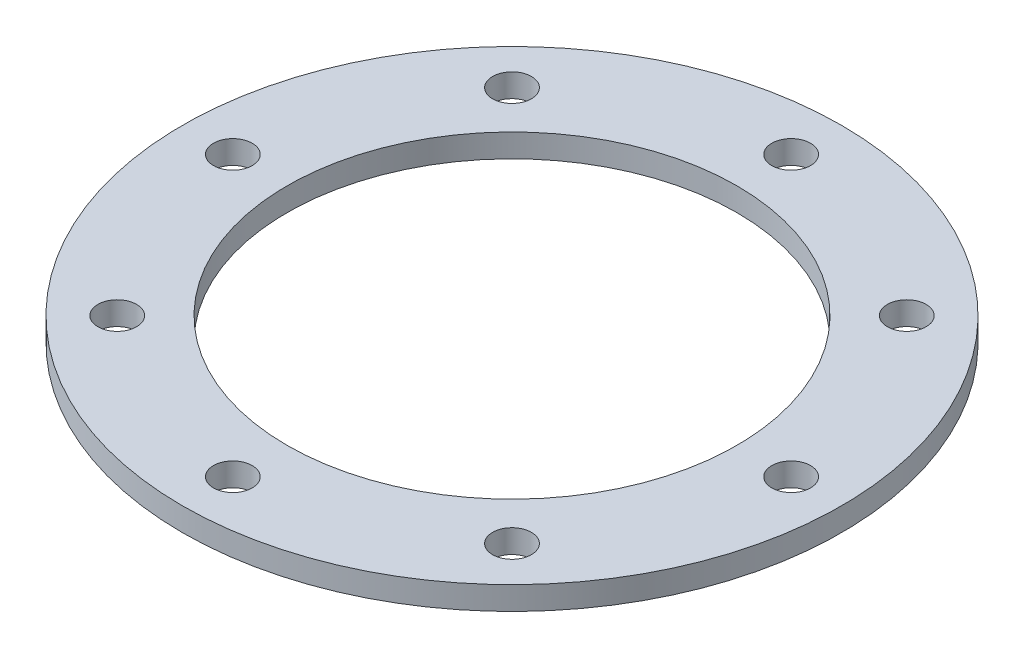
SolidWorks part; units mm, degrees
ref_plane "Front Plane" through (0, 0, 0) normal (0, 0, 1) x (1, 0, 0)
ref_plane "Top Plane" through (0, 0, 0) normal (0, 1, 0) x (1, 0, 0)
ref_plane "Right Plane" through (0, 0, 0) normal (1, 0, 0) x (0, 0, -1)
sketch "Sketch1" plane through (0, 0, 0) normal (0, 1, 0) x (1, 0, 0)
  circle A0 centre (0, 0) radius 42.5
  circle A1 centre (0, 0) radius 36 construction
  circle A2 centre (0, 0) radius 29
  circle A3 centre (36, 0) radius 2.5
  circle A4 centre (25.4558, -25.4558) radius 2.5
  circle A5 centre (0, -36) radius 2.5
  circle A6 centre (-25.4558, -25.4558) radius 2.5
  circle A7 centre (-36, 0) radius 2.5
  circle A8 centre (-25.4558, 25.4558) radius 2.5
  circle A9 centre (0, 36) radius 2.5
  circle A10 centre (25.4558, 25.4558) radius 2.5
  point P7 (7.2275, 36)
  point P8 (0, 0)
  point P24 (0, 0)
  dimension "D1" = 72
  dimension "D2" = 58
  dimension "D3" = 85
  dimension "D4" = 5
  dimension "D5" = 8
extrude "Boss-Extrude1" add sketch "Sketch1" along normal blind 3
